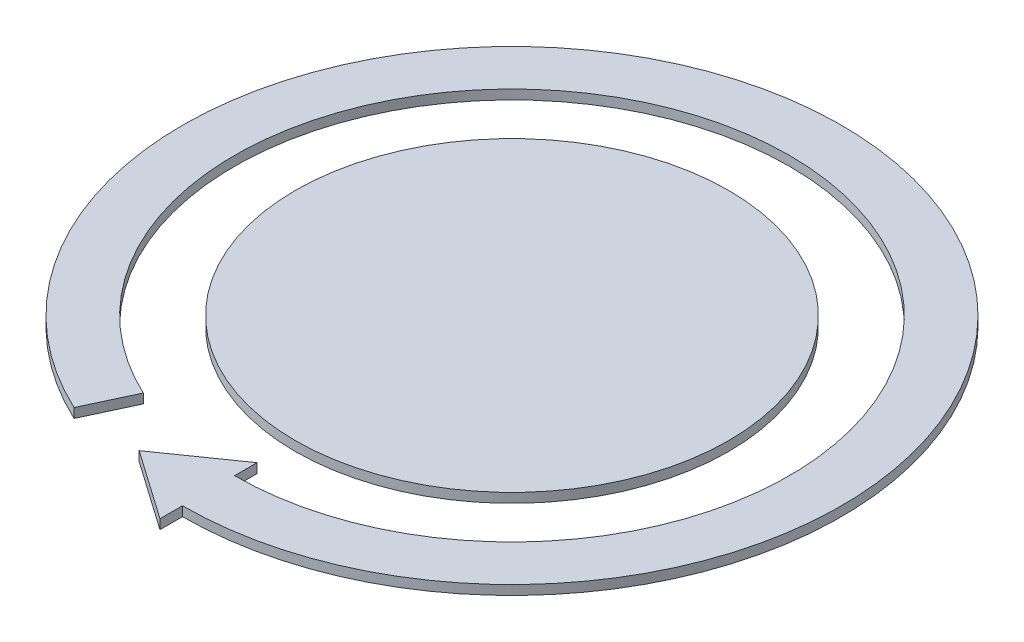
SolidWorks part; units mm, degrees
ref_plane "Ebene vorne" through (0, 0, 0) normal (0, 0, 1) x (1, 0, 0)
ref_plane "Ebene oben" through (0, 0, 0) normal (0, 1, 0) x (1, 0, 0)
ref_plane "Ebene rechts" through (0, 0, 0) normal (1, 0, 0) x (0, 0, -1)
sketch "Skizze1" plane through (0, 0, 0) normal (0, 1, 0) x (-1, 0, 0)
  line L0 (0, 0) -> (19.3347, 41.4636) construction
  line L1 (0, 74.3234) -> (0, 69.575)
  line L2 (14.6406, 64.0719) -> (0, 53.8204)
  line L3 (14.6406, 64.0719) -> (0, 74.3234)
  line L4 (0, 69.575) -> (0, 58.575) construction
  line L5 (0, 58.575) -> (0, 53.8204)
  line L6 (19.3347, 41.4636) -> (24.7548, 53.087) construction
  line L7 (24.7548, 53.087) -> (29.4035, 63.0564)
  circle A0 centre (0, 0) radius 45.75
  arc A1 (0, 58.575) -> (24.7548, 53.087) centre (0, 0) ccw
  arc A2 (0, 69.575) -> (29.4035, 63.0564) centre (0, 0) ccw
  arc A3 (7.3351, 69.1873) -> (0, 69.575) centre (0, 0) ccw construction
  arc A4 (6.3043, 58.2348) -> (0, 58.575) centre (0, 0) ccw construction
  arc A5 (24.7548, 53.087) -> (6.3043, 58.2348) centre (0, 0) ccw construction
  arc A6 (29.4035, 63.0564) -> (7.3351, 69.1873) centre (0, 0) ccw construction
  point P2 (0, 0)
  point P3 (0, 0)
  point P5 (0, 0)
  point P8 (0, 0)
  point P9 (0, 0)
  dimension "D1" = 91.5
  dimension "D2" = 117.15
  dimension "D3" = 139.15
  dimension "D4" = 25
  dimension "D5" = 55
  dimension "D6" = 55
  dimension "D7" = 53.8204
  dimension "D8" = 20.5029
extrude "Aufsatz-Linear austragen1" add sketch "Skizze1" along normal blind 2
